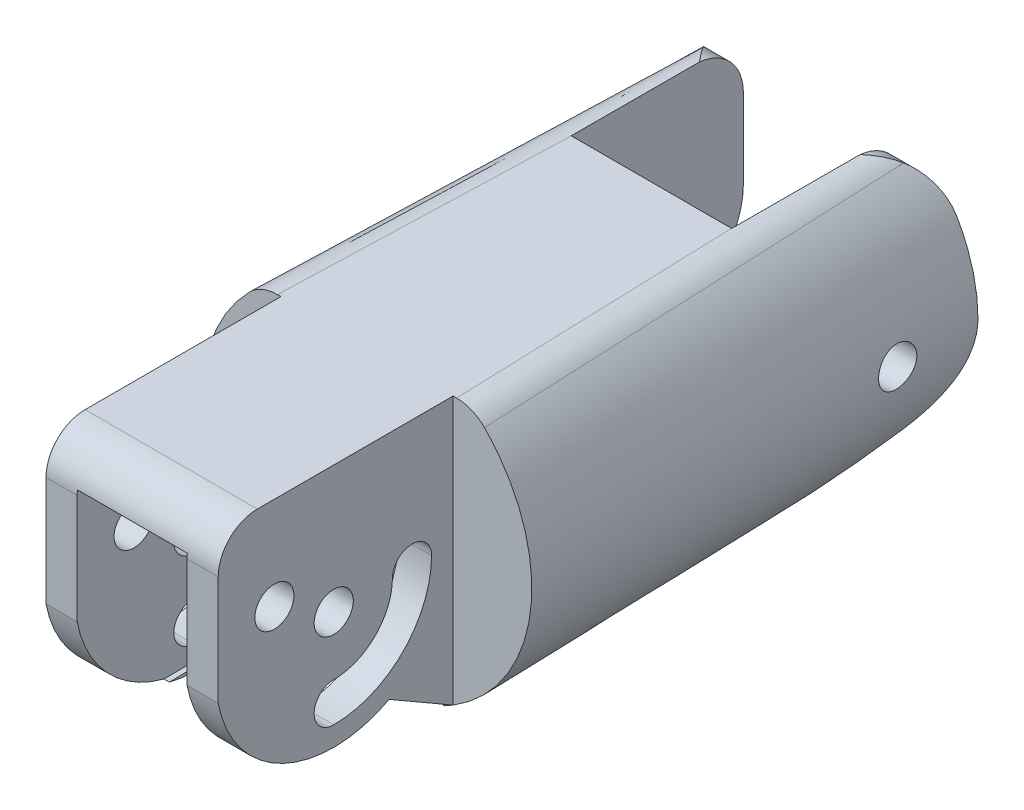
SolidWorks part; units mm, degrees
ref_plane "Front Plane" through (0, 0, 0) normal (0, 0, 1) x (1, 0, 0)
ref_plane "Top Plane" through (0, 0, 0) normal (0, 1, 0) x (1, 0, 0)
ref_plane "Right Plane" through (0, 0, 0) normal (1, 0, 0) x (0, 0, -1)
body saved out of another part "-index lincage-1"
